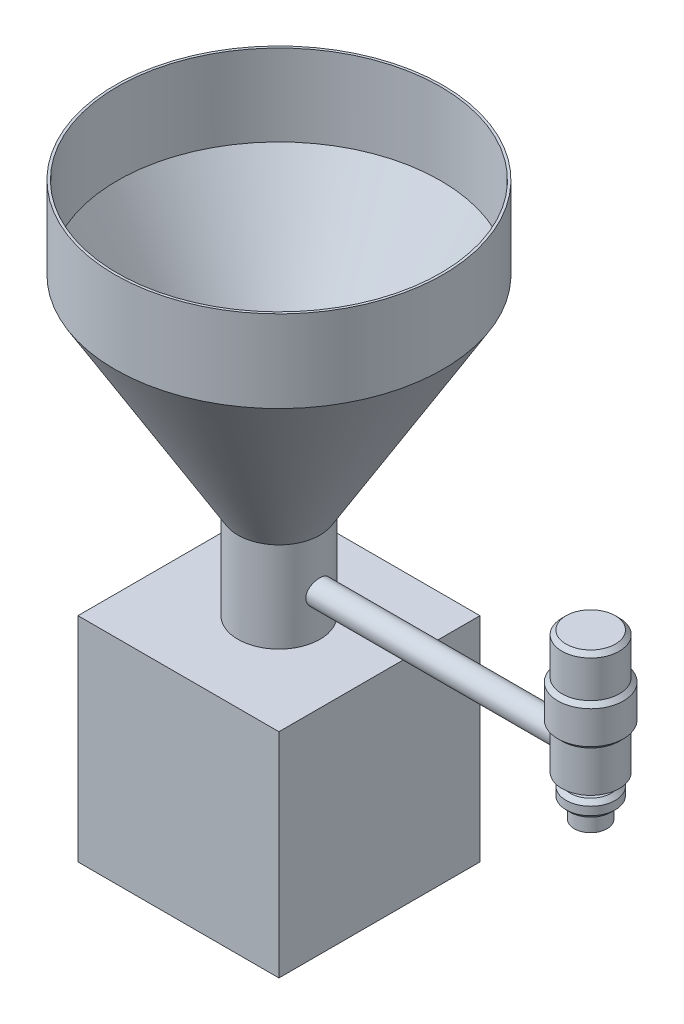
SolidWorks part; units mm, degrees
ref_plane "Face" through (0, 0, 0) normal (0, 0, 1) x (1, 0, 0)
ref_plane "Dessus" through (0, 0, 0) normal (0, 1, 0) x (1, 0, 0)
ref_plane "Droite" through (0, 0, 0) normal (1, 0, 0) x (0, 0, -1)
sketch "Esquisse1" plane through (0, 0, 0) normal (0, 0, 1) x (1, 0, 0)
  line L0 (0, 0) -> (0, 87.7513) construction
  line L1 (0, 200) -> (-35, 200)
  line L2 (-35, 200) -> (-35, 150)
  line L3 (-35, 150) -> (-40, 150)
  line L4 (-40, 150) -> (-40, 100)
  line L5 (-40, 100) -> (-35, 100)
  line L6 (-35, 100) -> (-35, 50)
  line L7 (-35, 50) -> (-17.5, 50)
  line L8 (-17.5, 50) -> (-17.5, 40)
  line L9 (-17.5, 40) -> (-30, 40)
  line L10 (-30, 40) -> (-30, 20)
  line L11 (-30, 20) -> (-20, 20)
  line L12 (-20, 20) -> (-20, 0)
  line L13 (-20, 0) -> (0, 0)
  line L14 (0, 0) -> (0, 200)
  dimension "D1" = 70
  dimension "D2" = 80
  dimension "D3" = 60
  dimension "D4" = 35
  dimension "D5" = 40
  dimension "D6" = 200
  dimension "D7" = 50
  dimension "D8" = 50
  dimension "D9" = 50
  dimension "D10" = 20
  dimension "D11" = 10
revolve "Base-Révolution" add sketch "Esquisse1" angle 360 about L0
chamfer "Chanfrein1" distance 5 angle 45
sketch "Esquisse2" plane through (0, 0, 0) normal (1, 0, 0) x (0, 0, -1)
  line L0 (0, 0) -> (0, 87.7513) construction
  line L1 (-20, 0) -> (20, 0) construction
  circle A0 centre (0, 75) radius 15
  dimension "D1" = 30
  dimension "D2" = 75
extrude "Boss.-Extru.1" add sketch "Esquisse2" against normal blind 380
sketch "Esquisse3" plane through (0, 0, 0) normal (0, 0, 1) x (1, 0, 0)
  line L0 (-380, 75) -> (-380, 835.752) construction
  line L1 (-380, 75) -> (-31.6228, 75) construction
  line L2 (-380, 90) -> (-380, 60) construction
  line L3 (-380, 485) -> (-580, 485)
  line L4 (-580, 485) -> (-580, 385)
  line L5 (-580, 385) -> (-430, 135)
  line L6 (-430, 135) -> (-430, 25)
  line L7 (-430, 25) -> (-380, 25)
  line L8 (-380, 485) -> (-380, 25)
  dimension "D1" = 100
  dimension "D2" = 400
  dimension "D3" = 250
  dimension "D4" = 110
  dimension "D5" = 50
  dimension "D6" = 100
revolve "Boss.-Révol.1" add sketch "Esquisse3" angle 360 about L0
shell "Coque1" thickness 3
sketch "Esquisse4" plane through (0, 0, 0) normal (0, -1, 0) x (1, 0, 0)
  circle A0 centre (0, 0) radius 10
  circle A1 centre (0, 0) radius 20 construction
  dimension "D1" = 20
extrude "Enlèv. mat.-Extru.1" cut sketch "Esquisse4" against normal blind 96
sketch "Esquisse5" plane through (0, 25, 0) normal (0, -1, 0) x (1, 0, 0)
  line L0 (-502.5, -122.5) -> (-257.5, 122.5) construction
  line L1 (-257.5, 122.5) -> (-502.5, 122.5)
  line L2 (-257.5, 122.5) -> (-257.5, -122.5)
  line L3 (-257.5, -122.5) -> (-502.5, -122.5)
  line L4 (-502.5, 122.5) -> (-502.5, -122.5)
  dimension "D1" = 245
extrude "Boss.-Extru.2" add sketch "Esquisse5" along normal blind 260
